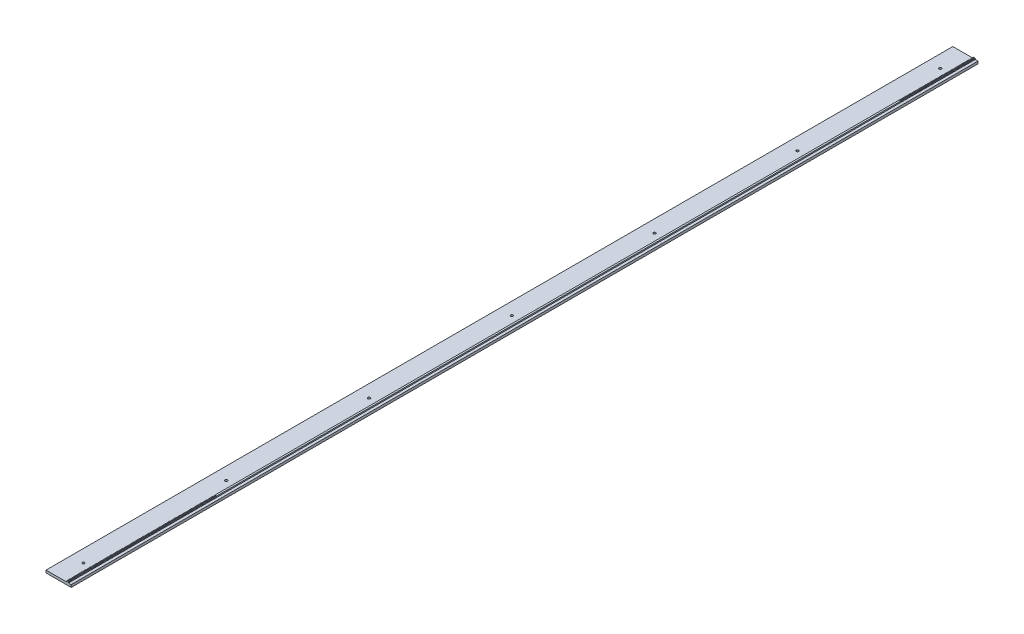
SolidWorks part; units mm, degrees
ref_plane "Front Plane" through (0, 0, 0) normal (0, 0, 1) x (1, 0, 0)
ref_plane "Top Plane" through (0, 0, 0) normal (0, 1, 0) x (1, 0, 0)
ref_plane "Right Plane" through (0, 0, 0) normal (1, 0, 0) x (0, 0, -1)
imported_body "Imported3"
hole_wizard "Hole1" positions "Sketch2" profile "Sketch1" legacy
sketch "Sketch2" plane through (0, 15.1437, 0) normal (0, 1, 0) x (-1, 0, 0)
  point P0 (-24.0388, 101.6)
sketch "Sketch1" plane through (24.0388, 15.1437, 101.6) normal (1, 0, 0) x (0, 0, 1)
  line L0 (0, 0) -> (0, 10)
  line L1 (0, 10) -> (4.953, 10)
  line L2 (4.953, 10) -> (4.953, 0)
  line L3 (4.953, 0) -> (0, 0)
  line L4 (0, 110) -> (0, -10) construction
  dimension "Diameter" = 9.906
  dimension "Depth" = 10
hole_wizard "Hole2" positions "Sketch4" profile "Sketch3" legacy
sketch "Sketch4" plane through (0, 15.1437, 0) normal (0, 1, 0) x (-1, 0, 0)
  point P0 (-24.0388, 677.545)
sketch "Sketch3" plane through (24.0388, 15.1437, 677.545) normal (1, 0, 0) x (0, 0, 1)
  line L0 (0, 0) -> (0, 10)
  line L1 (0, 10) -> (4.953, 10)
  line L2 (4.953, 10) -> (4.953, 0)
  line L3 (4.953, 0) -> (0, 0)
  line L4 (0, 110) -> (0, -10) construction
  dimension "Diameter" = 9.906
  dimension "Depth" = 10
hole_wizard "Hole3" positions "Sketch6" profile "Sketch5" legacy
sketch "Sketch6" plane through (0, 15.1437, 0) normal (0, 1, 0) x (-1, 0, 0)
  point P0 (-24.0388, 1253.49)
sketch "Sketch5" plane through (24.0388, 15.1437, 1253.49) normal (1, 0, 0) x (0, 0, 1)
  line L0 (0, 0) -> (0, 10)
  line L1 (0, 10) -> (4.953, 10)
  line L2 (4.953, 10) -> (4.953, 0)
  line L3 (4.953, 0) -> (0, 0)
  line L4 (0, 110) -> (0, -10) construction
  dimension "Diameter" = 9.906
  dimension "Depth" = 10
hole_wizard "Hole4" positions "Sketch8" profile "Sketch7" legacy
sketch "Sketch8" plane through (0, 15.1437, 0) normal (0, 1, 0) x (-1, 0, 0)
  point P0 (-24.0388, 1829.435)
sketch "Sketch7" plane through (24.0388, 15.1437, 1829.435) normal (1, 0, 0) x (0, 0, 1)
  line L0 (0, 0) -> (0, 10)
  line L1 (0, 10) -> (4.953, 10)
  line L2 (4.953, 10) -> (4.953, 0)
  line L3 (4.953, 0) -> (0, 0)
  line L4 (0, 110) -> (0, -10) construction
  dimension "Diameter" = 9.906
  dimension "Depth" = 10
hole_wizard "Hole5" positions "Sketch10" profile "Sketch9" legacy
sketch "Sketch10" plane through (0, 15.1437, 0) normal (0, 1, 0) x (-1, 0, 0)
  point P0 (-24.0388, 2405.38)
sketch "Sketch9" plane through (24.0388, 15.1437, 2405.38) normal (1, 0, 0) x (0, 0, 1)
  line L0 (0, 0) -> (0, 10)
  line L1 (0, 10) -> (4.953, 10)
  line L2 (4.953, 10) -> (4.953, 0)
  line L3 (4.953, 0) -> (0, 0)
  line L4 (0, 110) -> (0, -10) construction
  dimension "Diameter" = 9.906
  dimension "Depth" = 10
hole_wizard "Hole6" positions "Sketch12" profile "Sketch11" legacy
sketch "Sketch12" plane through (0, 15.1437, 0) normal (0, 1, 0) x (-1, 0, 0)
  point P0 (-24.0388, 2981.325)
sketch "Sketch11" plane through (24.0388, 15.1437, 2981.325) normal (1, 0, 0) x (0, 0, 1)
  line L0 (0, 0) -> (0, 10)
  line L1 (0, 10) -> (4.953, 10)
  line L2 (4.953, 10) -> (4.953, 0)
  line L3 (4.953, 0) -> (0, 0)
  line L4 (0, 110) -> (0, -10) construction
  dimension "Diameter" = 9.906
  dimension "Depth" = 10
hole_wizard "Hole7" positions "Sketch14" profile "Sketch13" legacy
sketch "Sketch14" plane through (0, 15.1437, 0) normal (0, 1, 0) x (-1, 0, 0)
  point P0 (-24.0388, 3557.27)
sketch "Sketch13" plane through (24.0388, 15.1437, 3557.27) normal (1, 0, 0) x (0, 0, 1)
  line L0 (0, 0) -> (0, 10)
  line L1 (0, 10) -> (4.953, 10)
  line L2 (4.953, 10) -> (4.953, 0)
  line L3 (4.953, 0) -> (0, 0)
  line L4 (0, 110) -> (0, -10) construction
  dimension "Diameter" = 9.906
  dimension "Depth" = 10
